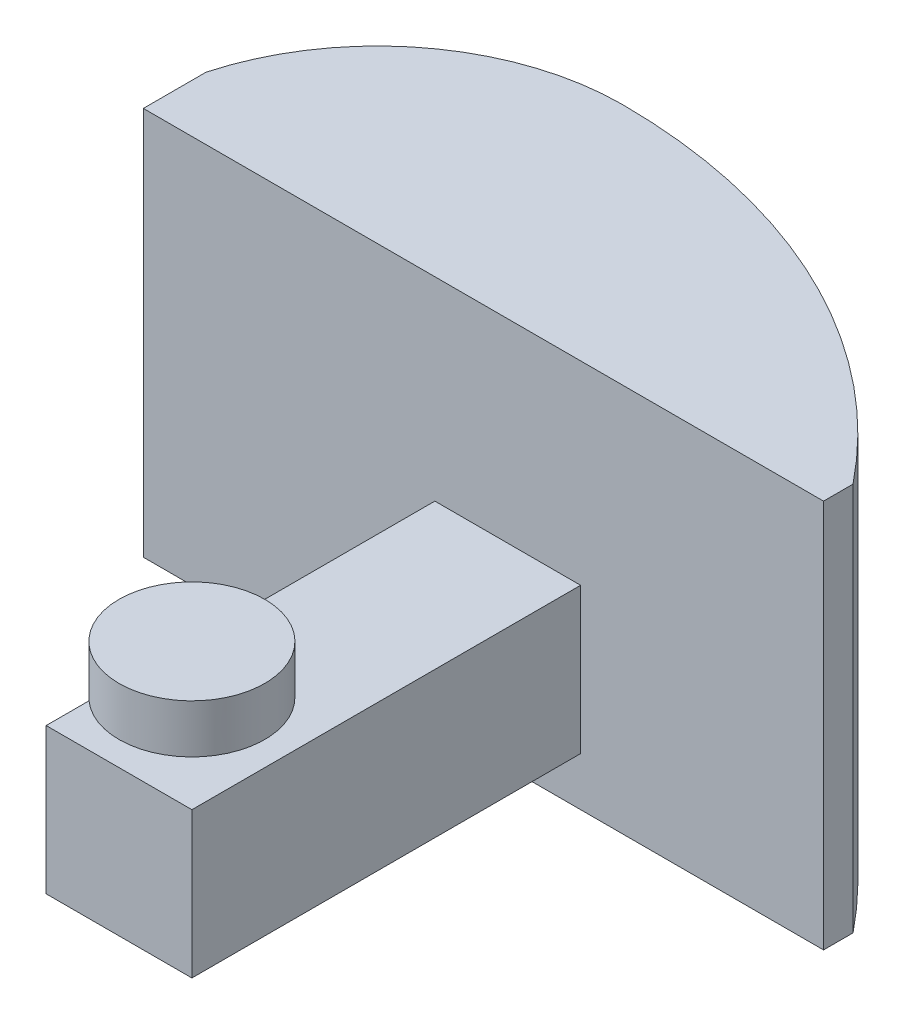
SolidWorks part; units mm, degrees
ref_plane "Plan1" through (0, 0, 0) normal (0, 0, 1) x (1, 0, 0)
ref_plane "Plan2" through (0, 0, 0) normal (0, 1, 0) x (1, 0, 0)
ref_plane "Plan3" through (0, 0, 0) normal (1, 0, 0) x (0, 0, -1)
sketch "Esquisse1" plane through (0, 0, 0) normal (0, 0, 1) x (1, 0, 0)
  line L1 (-9, 20) -> (-6, 20)
  line L2 (-9, 20) -> (-9, 17)
  line L3 (-9, 17) -> (-6, 17)
  line L4 (-6, 20) -> (-6, 17)
  dimension "D1" = 3
  dimension "D2" = 3
extrude "Base-Extrusion" add sketch "Esquisse1" along normal blind 8
sketch "Esquisse2" plane through (0, 0, 0) normal (0, 0, -1) x (-1, 0, 0)
  line L0 (9, 17) -> (6, 17) construction
  line L1 (15, 24) -> (1, 24)
  line L2 (15, 24) -> (15, 16)
  line L3 (15, 16) -> (1, 16)
  line L4 (1, 24) -> (1, 16)
  dimension "D1" = 8
  dimension "D2" = 14
  dimension "D3" = 1
  dimension "D4" = 5
extrude "Boss.-Extru.1" add sketch "Esquisse2" along normal blind 5
sketch "Esquisse3" plane through (0, 16, 0) normal (0, -1, 0) x (1, 0, 0)
  line L2 (-15, -5) -> (-15, 0) construction
  line L3 (-1, -5) -> (-15, -5) construction
  line L4 (-1, -5) -> (-1, 0) construction
  line L6 (-15, -1.2915) -> (-16.4007, -1.2915)
  line L7 (-16.4007, -1.2915) -> (-16.4007, -7.6297)
  line L8 (-16.4007, -7.6297) -> (1.3121, -7.6297)
  line L9 (1.3121, -7.6297) -> (1.3121, -0.6065)
  line L10 (1.3121, -0.6065) -> (-1, -0.6065)
  arc A0 (-15, -1.2915) -> (-10.1248, -5) centre (-10.1361, 0.0438) ccw
  arc A1 (-1, -0.6065) -> (-10.1248, -5) centre (-10.1512, 6.727) cw
extrude "Enlèv. mat.-Extru.1" cut sketch "Esquisse3" against normal through all
sketch "Esquisse4" plane through (0, 20, 0) normal (0, 1, 0) x (-1, 0, 0)
  line L0 (6, 8) -> (6, 0) construction
  line L1 (6, 0) -> (9, 0) construction
  circle A0 centre (8, 6) radius 1.5
  dimension "D1" = 3
  dimension "D2" = 2
  dimension "D3" = 6
extrude "Boss.-Extru.2" add sketch "Esquisse4" along normal blind 1
